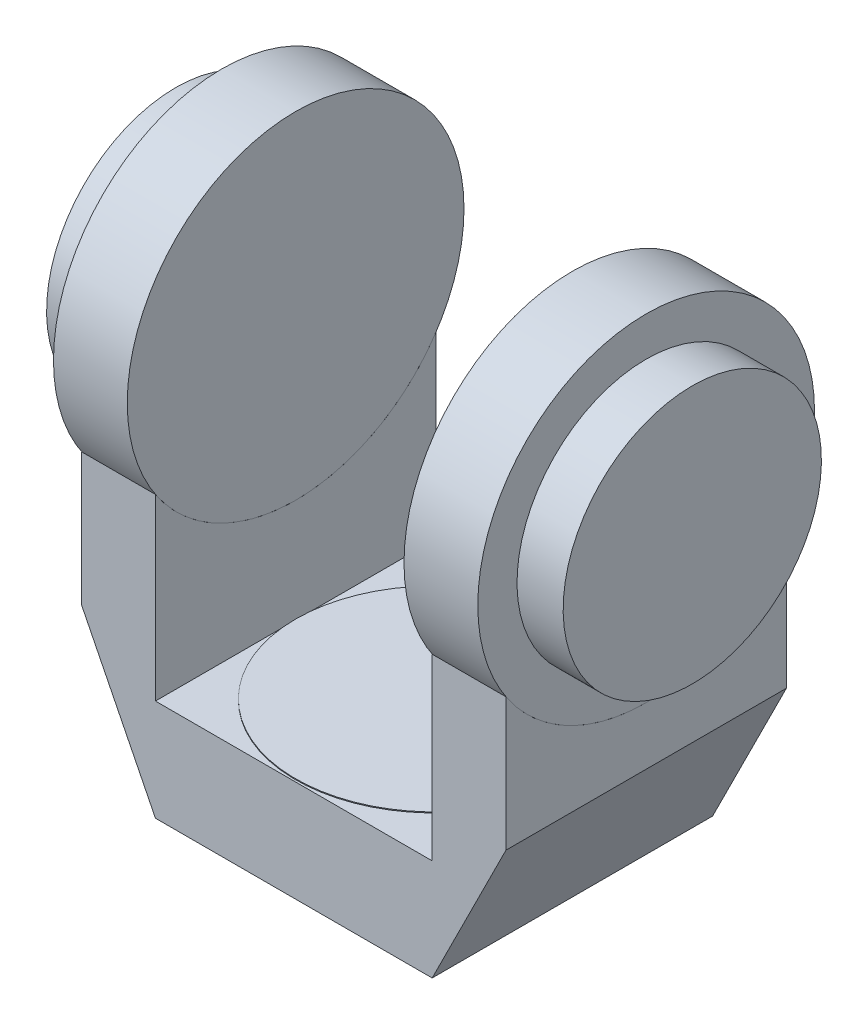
SolidWorks part; units mm, degrees
ref_plane "Front Plane" through (0, 0, 0) normal (0, 0, 1) x (1, 0, 0)
ref_plane "Top Plane" through (0, 0, 0) normal (0, 1, 0) x (1, 0, 0)
ref_plane "Right Plane" through (0, 0, 0) normal (1, 0, 0) x (0, 0, -1)
sketch "Sketch1" plane through (0, 0, 0) normal (0, 0, 1) x (1, 0, 0)
  line L0 (0, 110.5114) -> (0, -132.1023) construction
  line L1 (75, 0) -> (-75, 0)
  line L2 (-75, 0) -> (-115, 80)
  line L3 (-115, 80) -> (-115, 152)
  line L4 (-115, 152) -> (-75, 152)
  line L5 (-75, 152) -> (-75, 55)
  line L6 (-75, 55) -> (75, 55)
  line L7 (75, 152) -> (75, 55)
  line L8 (115, 152) -> (75, 152)
  line L9 (115, 80) -> (115, 152)
  line L10 (75, 0) -> (115, 80)
  point P28 (0, 55)
  point P32 (0, 0)
  dimension "D1" = 75
  dimension "D2" = 115
  dimension "D3" = 152
  dimension "D4" = 80
  dimension "D5" = 55
extrude "Boss-Extrude1" add sketch "Sketch1" along normal mid plane 152
sketch "Sketch2" plane through (115, 0, 0) normal (1, 0, 0) x (0, 0, -1)
  line L0 (0, 152) -> (0, 317.3307) construction
  line L1 (-76, 152) -> (76, 152) construction
  line L3 (-76, 152) -> (76, 152)
  arc A0 (-76, 152) -> (76, 152) centre (0, 202.5132) ccw
  dimension "D1" = 50.5132
extrude "Cut-Extrude1" cut sketch "Sketch2" against normal up to surface (230 mm away)
sketch "Sketch3" plane through (75, 0, 0) normal (-1, 0, 0) x (0, 0, 1)
  circle A0 centre (0.0044, 202.5132) radius 91.26
  arc A1 (-76, 152) -> (76, 152) centre (0, 202.5132) ccw construction
  dimension "D1" = 182.52
extrude "Boss-Extrude2" add sketch "Sketch3" against normal up to surface (40 mm away) separate body
sketch "Sketch4" plane through (115, 0, 0) normal (1, 0, 0) x (0, 0, -1)
  circle A0 centre (-0.0044, 202.5132) radius 70
  circle A1 centre (-0.0044, 202.5132) radius 91.26 construction
  dimension "D1" = 140
extrude "Boss-Extrude3" add sketch "Sketch4" along normal blind 25 separate body
mirror "Mirror5" about plane through (0, 0, 0) normal (1, 0, 0)
sketch "Sketch5" plane through (0, 55, 0) normal (0, 1, 0) x (1, 0, 0)
  line L0 (75, -76) -> (75, 76) construction
  line L1 (75, -76) -> (75, 76) construction
  circle A0 centre (0, 0) radius 75
extrude "Boss-Extrude5" add sketch "Sketch5" along normal blind 0.5 separate body
